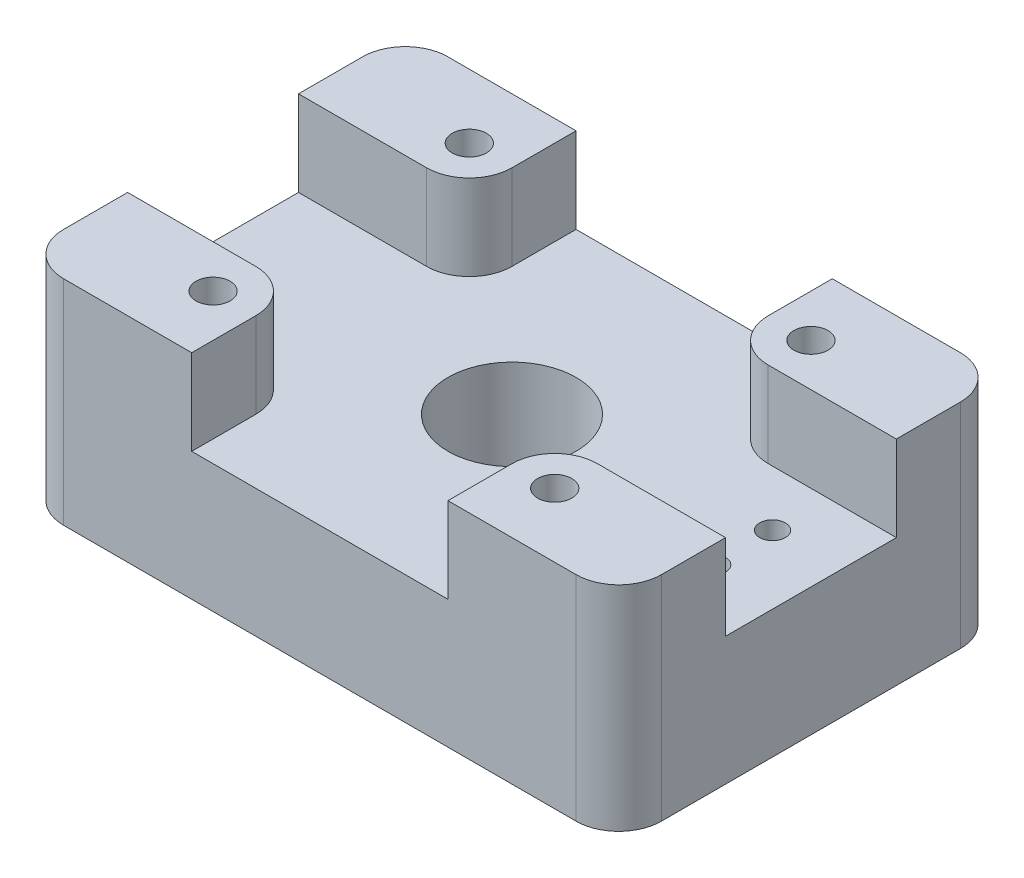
SolidWorks part; units mm, degrees
ref_plane "前视基准面" through (0, 0, 0) normal (0, 0, 1) x (1, 0, 0)
ref_plane "上视基准面" through (0, 0, 0) normal (0, 1, 0) x (1, 0, 0)
ref_plane "右视基准面" through (0, 0, 0) normal (1, 0, 0) x (0, 0, -1)
sketch "草图1" plane through (0, 0, 0) normal (0, 1, 0) x (1, 0, 0)
  line L0 (-93.5348, 0) -> (97.1477, 0) construction
  line L1 (-70, 45) -> (70, 45)
  line L2 (-70, 45) -> (-70, -45)
  line L3 (-70, -45) -> (70, -45)
  line L4 (70, 45) -> (70, -45)
  line L5 (0, -64.2299) -> (0, 61.8213) construction
  circle A0 centre (0, 0) radius 15
  dimension "D3" = 30
  dimension "D1" = 90
  dimension "D2" = 140
extrude "拉伸1" add sketch "草图1" along normal blind 30
sketch "草图2" plane through (0, 30, 0) normal (0, 1, 0) x (1, 0, 0)
  line L0 (-30, 45) -> (-30, 30)
  line L1 (70, 45) -> (-70, 45) construction
  line L2 (-40, 20) -> (-70, 20)
  line L3 (-70, 45) -> (-70, -45) construction
  line L4 (-70, 20) -> (-70, 45)
  line L5 (-70, 45) -> (-30, 45)
  line L6 (-50.9579, 0) -> (54.7573, 0) construction
  line L7 (0, 51.4049) -> (0, -54.3103) construction
  line L8 (-70, -20) -> (-70, -45)
  line L9 (-70, -45) -> (-30, -45)
  line L10 (-30, -45) -> (-30, -30)
  line L11 (-40, -20) -> (-70, -20)
  line L12 (70, -20) -> (70, -45)
  line L13 (70, -45) -> (30, -45)
  line L14 (30, -45) -> (30, -30)
  line L15 (40, -20) -> (70, -20)
  line L16 (70, 20) -> (70, 45)
  line L17 (70, 45) -> (30, 45)
  line L18 (30, 45) -> (30, 30)
  line L19 (40, 20) -> (70, 20)
  arc A0 (-30, 30) -> (-40, 20) centre (-40, 30) cw
  arc A1 (-30, -30) -> (-40, -20) centre (-40, -30) ccw
  arc A2 (30, -30) -> (40, -20) centre (40, -30) cw
  arc A3 (30, 30) -> (40, 20) centre (40, 30) ccw
  dimension "D3" = 10
  dimension "D1" = 15
  dimension "D2" = 40
extrude "拉伸2" add sketch "草图2" along normal blind 20
sketch "草图3" plane through (0, 0, 0) normal (0, -1, 0) x (1, 0, 0)
  line L0 (62, 37) -> (-62, 37)
  line L1 (-62, 37) -> (-62, -37)
  line L2 (-62, -37) -> (62, -37)
  line L3 (62, -37) -> (62, 37)
  line L4 (-70, 45) -> (-70, -45)
  line L5 (-70, -45) -> (70, -45)
  line L6 (70, -45) -> (70, 45)
  line L7 (70, 45) -> (-70, 45)
  line L8 (-70, 45) -> (-70, -45) construction
  line L9 (-70, -45) -> (70, -45) construction
  line L10 (70, -45) -> (70, 45) construction
  line L11 (70, 45) -> (-70, 45) construction
  circle A0 centre (0, 0) radius 22.5
  dimension "D3" = 45
  dimension "D1" = 0
  dimension "D2" = 8
extrude "切除-拉伸1" cut sketch "草图3" against normal blind 10
sketch "草图4" plane through (0, 50, 0) normal (0, 1, 0) x (1, 0, 0)
  line L0 (0, 0) -> (76.6603, 0) construction
  line L1 (70, -20) -> (70, 20) construction
  circle A0 centre (-40, 30) radius 4
  circle A1 centre (-40, -30) radius 4
  circle A2 centre (40, -30) radius 4
  circle A3 centre (40, 30) radius 4
  arc A4 (-40, 20) -> (-30, 30) centre (-40, 30) ccw construction
  arc A5 (-30, -30) -> (-40, -20) centre (-40, -30) ccw construction
  arc A6 (40, -20) -> (30, -30) centre (40, -30) ccw construction
  arc A7 (30, 30) -> (40, 20) centre (40, 30) ccw construction
  circle A8 centre (54, 7) radius 3
  circle A9 centre (54, -7) radius 3
  dimension "D1" = 8
  dimension "D2" = 8
  dimension "D3" = 8
  dimension "D4" = 8
  dimension "D5" = 6
  dimension "D6" = 14
  dimension "D7" = 16
extrude "切除-拉伸2" cut sketch "草图4" against normal through all
fillet "圆角1" radius 10 4 edges at (70, 25, 45) (70, 25, -45) (-70, 25, 45) (-70, 25, -45)
